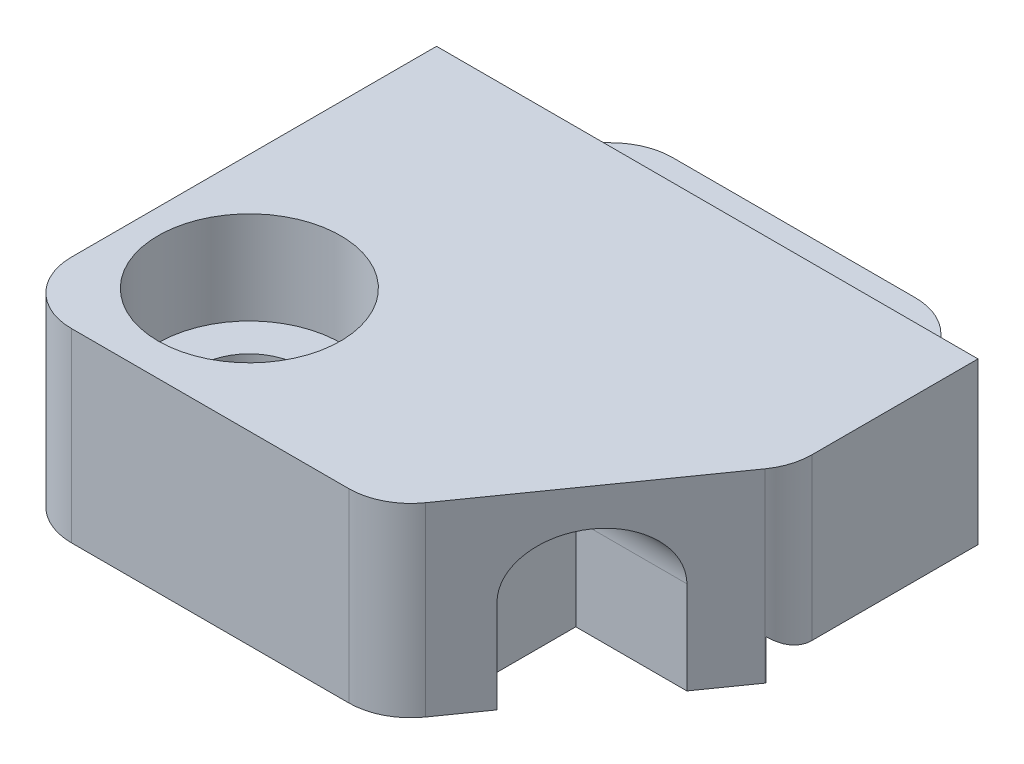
SolidWorks part; units mm, degrees
ref_plane "Спереди" through (0, 0, 0) normal (0, 0, 1) x (1, 0, 0)
ref_plane "Сверху" through (0, 0, 0) normal (0, 1, 0) x (1, 0, 0)
ref_plane "Справа" through (0, 0, 0) normal (1, 0, 0) x (0, 0, -1)
sketch "Эскиз1" plane through (0, 0, 0) normal (0, 1, 0) x (1, 0, 0)
  line L0 (0, 12.7914) -> (0, 0) construction
  line L1 (0, 0) -> (16.1105, 0) construction
  line L2 (6.75, 8.8) -> (-6.75, 8.8)
  line L3 (-6.75, 8.8) -> (-6.75, 6)
  line L4 (-6.75, 6) -> (-8.75, 6)
  line L5 (-8.75, 6) -> (-8.75, -7.8)
  line L6 (-8.75, -7.8) -> (3.25, -7.8)
  line L7 (3.25, -7.8) -> (8.75, 0)
  line L8 (8.75, 0) -> (8.75, 6)
  line L9 (6.75, 8.8) -> (6.75, 6)
  line L10 (6.75, 6) -> (8.75, 6)
  circle A0 centre (-5, -3.8) radius 1.65
  point P13 (0, 8.8)
  dimension "D6" = 3.3
  dimension "D9" = 3.8
  dimension "D1" = 13.5
  dimension "D2" = 2
  dimension "D3" = 2.8
  dimension "D4" = 13.8
  dimension "D5" = 3.75
  dimension "D7" = 12
  dimension "D8" = 6
extrude "Бобышка-Вытянуть1" add sketch "Эскиз1" along normal blind 6
sketch "Эскиз2" plane through (0, 6, 0) normal (0, 1, 0) x (1, 0, 0)
  circle A0 centre (-5, -3.8) radius 2.95
  dimension "D1" = 5.9
extrude "Вырез-Вытянуть1" cut sketch "Эскиз2" against normal blind 3
fillet "Скругление1" radius 2 3 edges at (8.75, 3, 0) (3.25, 3, 7.8) (-8.75, 3, 7.8)
sketch "Эскиз3" plane through (-8.75, 0, 0) normal (-1, 0, 0) x (0, 0, 1)
  line L0 (-6, 6) -> (-6, 0) construction
  line L1 (-8.8, 6) -> (-6, 6)
  line L2 (-8.8, 6) -> (-8.8, 3.9)
  line L3 (-8.8, 3.9) -> (-6, 3.9)
  line L4 (-6, 6) -> (-6, 3.9)
  line L5 (-6, 2.2) -> (-6, 0.8)
  line L6 (-8.8, 0) -> (0.5, 0)
  line L7 (-8.8, 0) -> (-8.8, 2.2)
  line L8 (-8.8, 2.2) -> (-6, 2.2)
  line L9 (0.5, 0) -> (0.5, 0.8)
  line L10 (-6, 0.8) -> (0.5, 0.8)
  dimension "D1" = 2.1
  dimension "D2" = 2.2
  dimension "D3" = 6.5
  dimension "D4" = 0.8
extrude "Вырез-Вытянуть2" cut sketch "Эскиз3" against normal through all
chamfer "Фаска1" distance 2 angle 45 2 edges at (6.75, 3.05, -8.8) (-6.75, 3.05, -8.8)
fillet "Скругление2" radius 2 4 edges at (6.75, 3.05, -6.8) (4.75, 3.05, -8.8) (-4.75, 3.05, -8.8) (-6.75, 3.05, -6.8)
sketch "Эскиз4" plane through (0, 0, -6) normal (0, 0, -1) x (-1, 0, 0)
  line L0 (-6.25, 1.5) -> (-6.75, 0.8)
  line L1 (-6.25, 1.5) -> (-5.65, 1.5)
  line L2 (-8.25, 1.5) -> (-8.75, 0.8)
  line L3 (-8.25, 1.5) -> (-7.65, 1.5)
  line L4 (-7.65, 1.5) -> (-7.15, 0.8)
  line L5 (-7.15, 0.8) -> (-6.75, 0.8)
  line L6 (-5.65, 1.5) -> (-5.15, 0.8)
  line L7 (-5.15, 0.8) -> (-4.75, 0.8)
  line L8 (-4.25, 1.5) -> (-4.75, 0.8)
  line L9 (-4.25, 1.5) -> (-3.65, 1.5)
  line L10 (-3.65, 1.5) -> (-3.15, 0.8)
  line L11 (-3.15, 0.8) -> (-2.75, 0.8)
  line L12 (-2.25, 1.5) -> (-2.75, 0.8)
  line L13 (-2.25, 1.5) -> (-1.65, 1.5)
  line L14 (-1.65, 1.5) -> (-1.15, 0.8)
  line L15 (-1.15, 0.8) -> (-0.75, 0.8)
  line L16 (-0.25, 1.5) -> (-0.75, 0.8)
  line L17 (-0.25, 1.5) -> (0.35, 1.5)
  line L18 (0.35, 1.5) -> (0.85, 0.8)
  line L19 (0.85, 0.8) -> (1.25, 0.8)
  line L20 (1.75, 1.5) -> (1.25, 0.8)
  line L21 (1.75, 1.5) -> (2.35, 1.5)
  line L22 (2.35, 1.5) -> (2.85, 0.8)
  line L23 (2.85, 0.8) -> (3.25, 0.8)
  line L24 (3.75, 1.5) -> (3.25, 0.8)
  line L25 (3.75, 1.5) -> (4.35, 1.5)
  line L26 (-8.75, 0.8) -> (-8.75, 0)
  line L27 (4.35, 1.5) -> (4.85, 0.8)
  line L28 (4.85, 0.8) -> (5.25, 0.8)
  line L29 (5.75, 1.5) -> (5.25, 0.8)
  line L30 (5.75, 1.5) -> (6.35, 1.5)
  line L31 (6.35, 1.5) -> (6.85, 0.8)
  line L32 (6.85, 0.8) -> (7.25, 0.8)
  line L33 (7.75, 1.5) -> (7.25, 0.8)
  line L34 (7.75, 1.5) -> (8.35, 1.5)
  line L35 (8.35, 1.5) -> (8.85, 0.8)
  line L36 (8.85, 0.8) -> (9.25, 0.8)
  line L37 (-8.75, 0) -> (9.25, 0)
  line L38 (9.25, 0) -> (9.25, 0.8)
  line L39 (-8.3973, 0) -> (8.75, 0) construction
  dimension "D1" = 0.6
  dimension "D2" = 0.7
  dimension "D3" = 1.6
  dimension "D4" = 0.4
  dimension "D5" = 9
extrude "Вырез-Вытянуть3" cut sketch "Эскиз4" against normal blind 6.5
sketch "Эскиз5" plane through (8.75, 0, 0) normal (1, 0, 0) x (0, 0, -1)
  line L0 (-2, 3) -> (-2, 0)
  line L1 (-6.9525, 0) -> (-0.5183, 0) construction
  line L2 (-2, 0) -> (-5.6, 0)
  line L3 (-5.6, 0) -> (-5.6, 3)
  line L4 (-7.8, 0) -> (-7.8, 6) construction
  arc A0 (-2, 3) -> (-5.6, 3) centre (-3.8, 3) ccw
  dimension "D1" = 1.8
  dimension "D2" = 4
  dimension "D3" = 3
extrude "Вырез-Вытянуть4" cut sketch "Эскиз5" against normal blind 5
